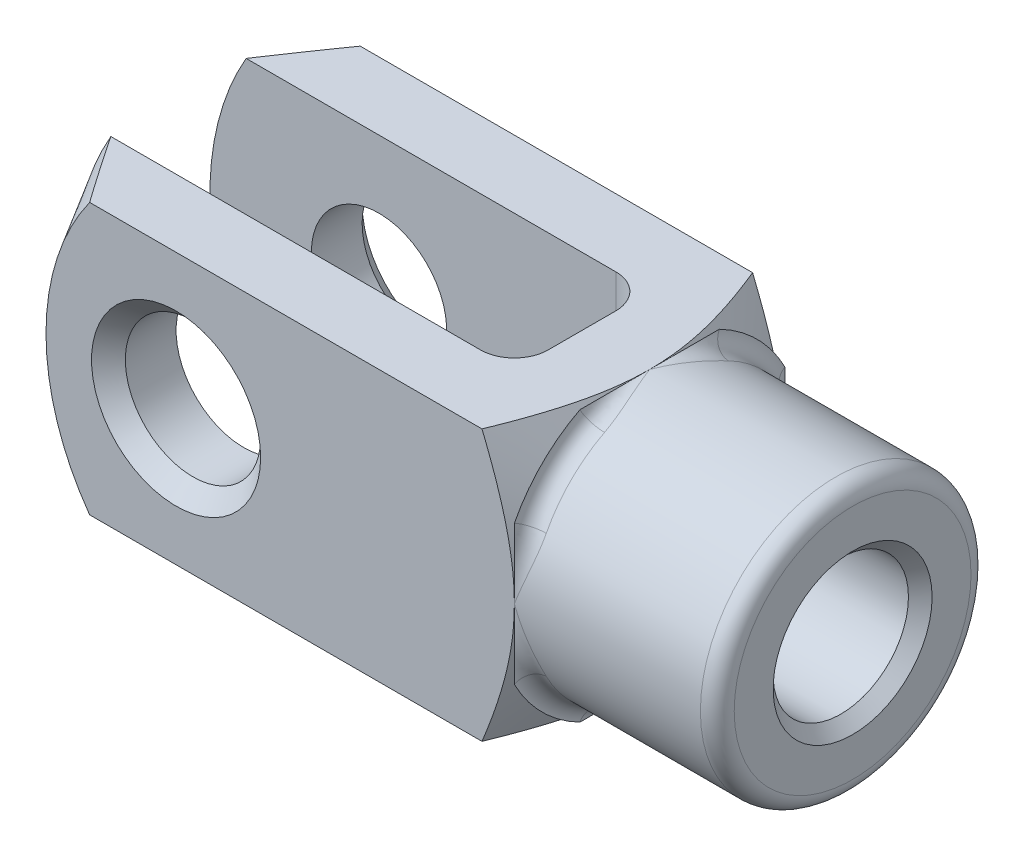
SolidWorks part; units mm, degrees
ref_plane "Front Plane" through (0, 0, 0) normal (0, 0, 1) x (1, 0, 0)
ref_plane "Top Plane" through (0, 0, 0) normal (0, 1, 0) x (1, 0, 0)
ref_plane "Right Plane" through (0, 0, 0) normal (1, 0, 0) x (0, 0, -1)
sketch "Sketch1" plane through (0, 0, 0) normal (1, 0, 0) x (0, 0, -1)
  line L0 (0, 0) -> (0, 50000) construction
  line L1 (0, 0) -> (50000, 0) construction
  line L2 (-4, -4) -> (-4, 4)
  line L3 (-4, 4) -> (4, 4)
  line L4 (4, -4) -> (4, 4)
  line L5 (-4, -4) -> (4, -4)
  point P9 (0, 4)
  point P11 (4, 0)
  point P12 (-4, 0)
  dimension "D1" = 8
  dimension "D2" = 8
extrude "Extrude1" add sketch "Sketch1" against normal blind 21
sketch "Sketch2" plane through (0, 0, 0) normal (1, 0, 0) x (0, 0, -1)
  circle A0 centre (0, 0) radius 4
  circle A1 centre (0, 0) radius 8
  dimension "D1" = 8
  dimension "D2" = 16
extrude "Extrude2" cut sketch "Sketch2" against normal blind 6
sketch "Sketch3" plane through (0, 0, 4) normal (0, 0, 1) x (1, 0, 0)
  circle A0 centre (-16, 0) radius 2
  dimension "D1" = 4
  dimension "D2" = 16
extrude "Extrude3" cut sketch "Sketch3" against normal through all
sketch "Sketch4" plane through (0, 4, 0) normal (0, 1, 0) x (1, 0, 0)
  line L0 (0, 0) -> (-50000, 0) construction
  line L1 (-21, -2) -> (-21, 2)
  line L2 (-21, 4) -> (-21, -4) construction
  line L3 (-21, 2) -> (-8, 2)
  line L4 (-8, 2) -> (-8, -2)
  line L5 (-16, 4) -> (-16, -4) construction
  line L6 (-21, -2) -> (-8, -2)
  point P7 (-16, 0)
  point P13 (-8, 0)
  point P14 (-21, 0)
  dimension "D1" = 8
  dimension "D2" = 4
extrude "Extrude4" cut sketch "Sketch4" against normal through all
fillet "Fillet1" radius 1 2 edges at (-8, 0, 2) (-8, 0, -2)
fillet "Fillet2" radius 0.5 5 edges at (0, 0, -4) (-6, 2.8284, 2.8284) (-6, 2.8284, -2.8284) (-6, -2.8284, -2.8284) (-6, -2.8284, 2.8284)
chamfer "Chamfer2" distance 0.5 angle 45 2 edges at (-14, 0, -4) (-14, 0, 4)
sketch "Sketch6" plane through (0, 0, 0) normal (0, 0, 1) x (1, 0, 0)
  line L0 (-6, -4) -> (-6, -8)
  line L1 (-6, -8) -> (-8.3094, -8)
  line L2 (-8.3094, -8) -> (-6, -4)
  dimension "D1" = 30
  dimension "D2" = 8
revolve "Cut-Revolve1" cut sketch "Sketch6" angle 360 about axis through (-6, 0, 0) along (1, 0, 0)
sketch "Sketch7" plane through (0, 0, 0) normal (0, 1, 0) x (1, 0, 0)
  line L0 (-19.8453, -4) -> (-21, -2)
  line L1 (-21, 2) -> (-19.8453, 4)
  line L2 (-19.8453, 4) -> (-29, 4)
  line L3 (-21, 2) -> (-21, -2)
  line L4 (-29, 4) -> (-29, -4)
  line L5 (-29, -4) -> (-19.8453, -4)
  line L6 (-21, 4) -> (-6.9566, 4) construction
  line L7 (-21, -4) -> (-6.9566, -4) construction
  line L8 (-13, 0.6162) -> (-13, 50000.6162) construction
  dimension "D1" = 120
  dimension "D2" = 8
  dimension "D3" = 8
revolve "Cut-Revolve2" cut sketch "Sketch7" angle 180 about L8
sketch "Sketch8" plane through (0, 0, 0) normal (1, 0, 0) x (0, 0, -1)
  circle A0 centre (0, 0) radius 2
  dimension "D1" = 4
extrude "Extrude5" cut sketch "Sketch8" against normal through all
chamfer "Chamfer3" distance 0.35 angle 45 1 edges at (0, 0, -2)
equation "\"D2@Sketch1\" = \"D1@Sketch1\""
equation "\"D2@Sketch2\" = \"D1@Sketch2\"*2"
equation "\"D2@Sketch6\" = \"D1@Sketch1\""
equation "\"D2@Sketch7\" = \"D1@Sketch1\""
equation "\"D3@Sketch7\" = \"D1@Sketch1\""
